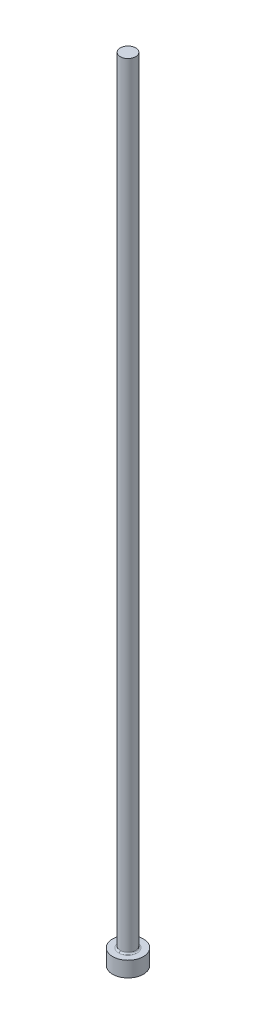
SolidWorks part; units mm, degrees
ref_plane "Plan de face" through (0, 0, 0) normal (0, 0, 1) x (1, 0, 0)
ref_plane "Plan de dessus" through (0, 0, 0) normal (0, 1, 0) x (1, 0, 0)
ref_plane "Plan de droite" through (0, 0, 0) normal (1, 0, 0) x (0, 0, -1)
imported_body "Importée1"
sketch "Esquisse1" plane through (0, -8.6275, 0) normal (0, 1, 0) x (1, 0, 0)
  circle A0 centre (-13.7025, -109.8) radius 1 construction
  circle A1 centre (-13.7025, -109.8) radius 1
extrude "Extrusion1" add sketch "Esquisse1" along normal blind 5.58
